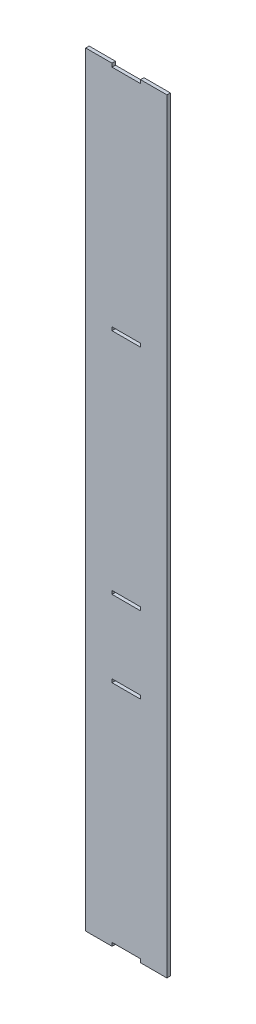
SolidWorks part; units mm, degrees
ref_plane "Front Plane" through (0, 0, 0) normal (0, 0, 1) x (1, 0, 0)
ref_plane "Top Plane" through (0, 0, 0) normal (0, 1, 0) x (1, 0, 0)
ref_plane "Right Plane" through (0, 0, 0) normal (1, 0, 0) x (0, 0, -1)
sketch "Sketch1" plane through (0, 0, 0) normal (0, 0, 1) x (1, 0, 0)
  line L0 (-6.35, 338.8496) -> (-6.35, 337.3256)
  line L1 (18.0601, -1.524) -> (6.35, -1.524)
  line L2 (18.0601, -1.524) -> (18.0601, 338.8496)
  line L3 (18.0601, 338.8496) -> (6.35, 338.8496)
  line L4 (-18.0601, -1.524) -> (-18.0601, 338.8496)
  line L5 (-6.35, 337.3256) -> (6.35, 337.3256)
  line L6 (6.35, 337.3256) -> (6.35, 338.8496)
  line L7 (-6.35, 338.8496) -> (-18.0601, 338.8496)
  line L8 (6.35, -1.524) -> (6.35, 0)
  line L9 (6.35, 237.2496) -> (-6.35, 237.2496)
  line L10 (6.35, 237.2496) -> (6.35, 235.7256)
  line L11 (6.35, 235.7256) -> (-6.35, 235.7256)
  line L12 (-6.35, 237.2496) -> (-6.35, 235.7256)
  line L13 (6.35, 135.6496) -> (-6.35, 135.6496)
  line L14 (6.35, 135.6496) -> (6.35, 134.1256)
  line L15 (6.35, 134.1256) -> (-6.35, 134.1256)
  line L16 (-6.35, 135.6496) -> (-6.35, 134.1256)
  line L17 (6.35, 101.6) -> (-6.35, 101.6)
  line L18 (6.35, 101.6) -> (6.35, 100.076)
  line L19 (6.35, 100.076) -> (-6.35, 100.076)
  line L20 (-6.35, 101.6) -> (-6.35, 100.076)
  line L21 (6.35, 0) -> (-6.35, 0)
  line L22 (-6.35, 0) -> (-6.35, -1.524)
  line L23 (-6.35, -1.524) -> (-18.0601, -1.524)
extrude "Boss-Extrude1" add sketch "Sketch1" along normal blind 1.524
